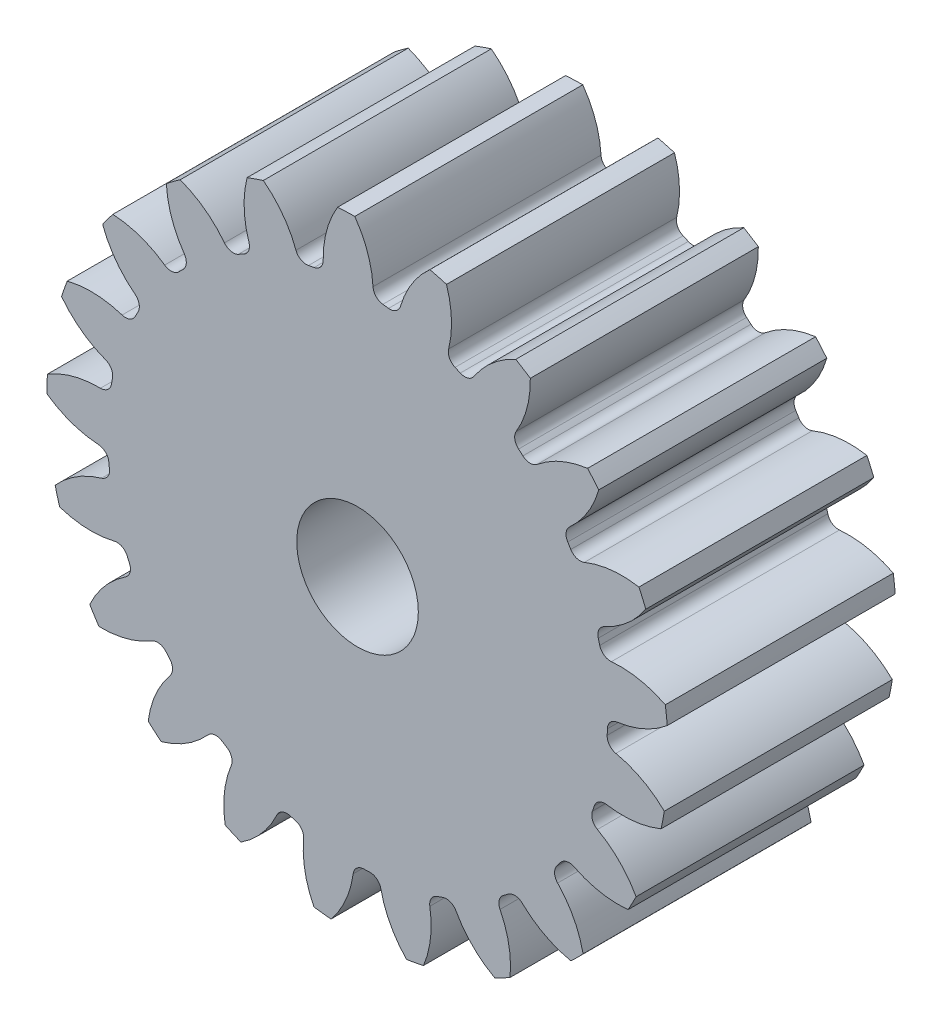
SolidWorks part; units mm, degrees
ref_plane "Front" through (0, 0, 0) normal (0, 0, 1) x (1, 0, 0)
ref_plane "Top" through (0, 0, 0) normal (0, 1, 0) x (1, 0, 0)
ref_plane "Right" through (0, 0, 0) normal (1, 0, 0) x (0, 0, -1)
sketch "Sketch3" plane through (0, 0, 0) normal (0, 0, 1) x (1, 0, 0)
  circle A0 centre (0, 0) radius 129.8222
  dimension "od" = 259.6444
extrude "gearBody" add sketch "Sketch3" along normal blind 95.25
sketch "Sketch2" plane through (0, 0, 0) normal (0, 0, 1) x (1, 0, 0)
  line L0 (0, 0) -> (102.9062, 42.6252) construction
  line L1 (128.5833, -21.1256) -> (0, 0) construction
  line L2 (0, 0) -> (36.3143, 0) construction
  line L3 (118.455, 4.3074) -> (117.7789, -13.3523) construction
  line L5 (118.117, -4.5224) -> (0, 0) construction
  line L7 (0, 0) -> (111.3849, 0) construction
  arc A0 (111.3642, 2.147) -> (110.874, -10.6561) centre (0, 0) ccw construction
  arc A1 (129.3682, 10.8481) -> (128.16, -20.7083) centre (0, 0) ccw construction
  arc A2 (118.455, 4.3074) -> (117.7789, -13.3523) centre (0, 0) ccw construction
  arc A3 (104.293, -5.194) -> (104.3848, -2.7958) centre (0, 0) ccw
  arc A4 (128.5833, -21.1256) -> (107.9283, -9.9171) centre (99.3457, -50.3689) ccw
  arc A5 (128.5833, -21.1256) -> (129.8222, 11.2318) centre (0, 0) ccw
  arc A6 (129.8222, 11.2318) -> (108.3706, 1.6354) centre (102.9062, 42.6252) cw
  arc A7 (104.3848, -2.7958) -> (108.3706, 1.6354) centre (108.9777, -2.9188) cw
  arc A8 (107.9283, -9.9171) -> (104.293, -5.194) centre (108.8819, -5.4225) cw
  point P6 (129.8222, 11.2318)
  point P22 (128.5833, -21.1256)
  dimension "baseDia" = 222.7698
  dimension "od" = 259.6444
  dimension "pd" = 237.0667
  dimension "rd" = 208.8444
  dimension "rFillet" = 4.5946
  dimension "pointX" = 129.8222
  dimension "pointY" = 11.2318
  dimension "CTT" = 17.6597
  dimension "flankCenterAngle" = 22.5
extrude "toothCut" cut sketch "Sketch2" along normal through all
pattern_circular "CirPattern1" count 21 over 360 about axis through (0, 0, 0) along (0, 0, 1) of "toothCut"
sketch "hub1Dia" plane through (0, 0, 0) normal (0, 0, -1) x (-1, 0, 0)
  circle A0 centre (0, 0) radius 12.7
  dimension "hub1Dia" = 25.4
sketch "hub2Dia" plane through (0, 0, 95.25) normal (0, 0, 1) x (1, 0, 0)
  circle A0 centre (0, 0) radius 12.7
  dimension "hub2dia" = 25.4
sketch "boreDia" plane through (0, 0, 0) normal (0, 0, 1) x (1, 0, 0)
  circle A0 centre (0, 0) radius 25.4
  dimension "boreDia" = 50.8
extrude "bore" cut sketch "boreDia" against normal mid plane 25400
